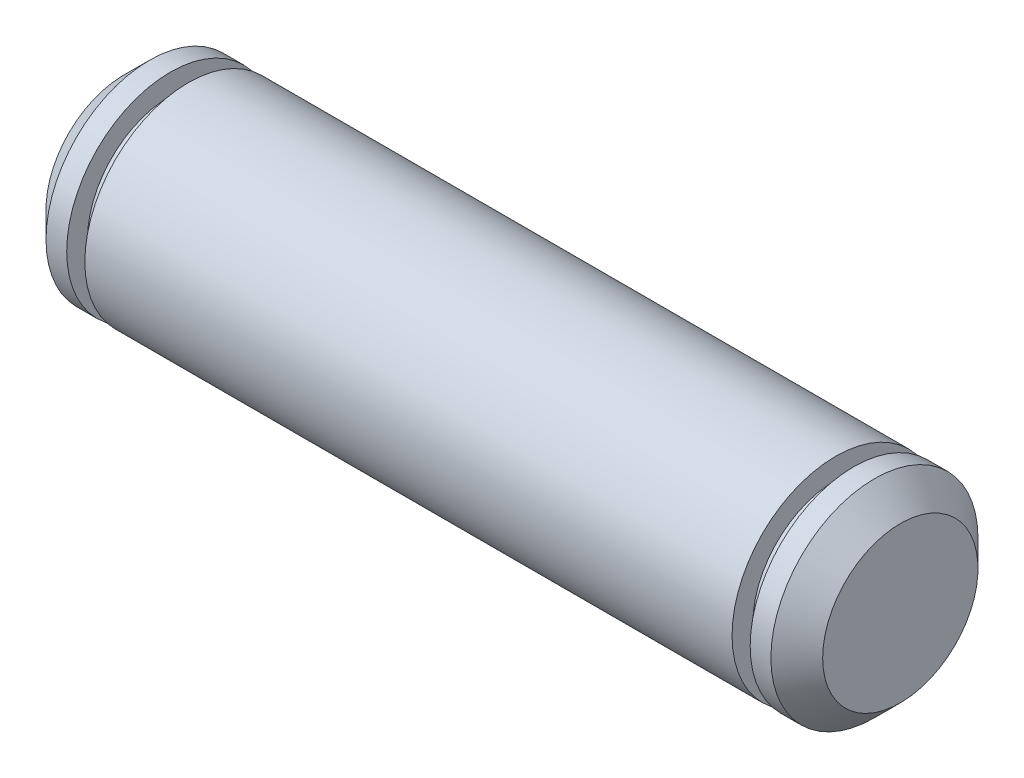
SolidWorks part; units mm, degrees
ref_plane "Plan1" through (0, 0, 0) normal (0, 0, 1) x (1, 0, 0)
ref_plane "Plan2" through (0, 0, 0) normal (0, 1, 0) x (1, 0, 0)
ref_plane "Plan3" through (0, 0, 0) normal (1, 0, 0) x (0, 0, -1)
sketch "Esquisse1" plane through (0, 0, 0) normal (0, 0, 1) x (1, 0, 0)
  line L0 (-81.8, 26.8) -> (-81.8, 30.8)
  line L1 (-81.8, 30.8) -> (-80, 30.8)
  line L2 (-80, 30.8) -> (-80, 30)
  line L3 (-80, 30) -> (-79.3, 30)
  line L4 (-79.3, 30) -> (-79.3, 30.8)
  line L5 (-79.3, 30.8) -> (-54.3, 30.8)
  line L6 (-54.3, 30.8) -> (-54.3, 30)
  line L7 (-54.3, 30) -> (-53.6, 30)
  line L8 (-53.6, 30) -> (-53.6, 30.8)
  line L9 (-53.6, 30.8) -> (-51.8, 30.8)
  line L10 (-51.8, 30.8) -> (-51.8, 26.8)
  line L11 (-51.8, 26.8) -> (-81.8, 26.8)
  line L12 (-101.8, 26.8) -> (138.2, 26.8) construction
  dimension "D1" = 25
  dimension "D2" = 4
  dimension "D3" = 0.7
  dimension "D4" = 0.7
  dimension "D5" = 1.8
  dimension "D6" = 1.8
  dimension "D7" = 0.8
revolve "Base-Révolution" add sketch "Esquisse1" angle 360 about L12
chamfer "Chanfrein1" distance 1 angle 45
ref_plane "Plan4" through (0, 26.8, 0) normal (0, 1, 0) x (-1, 0, 0)
